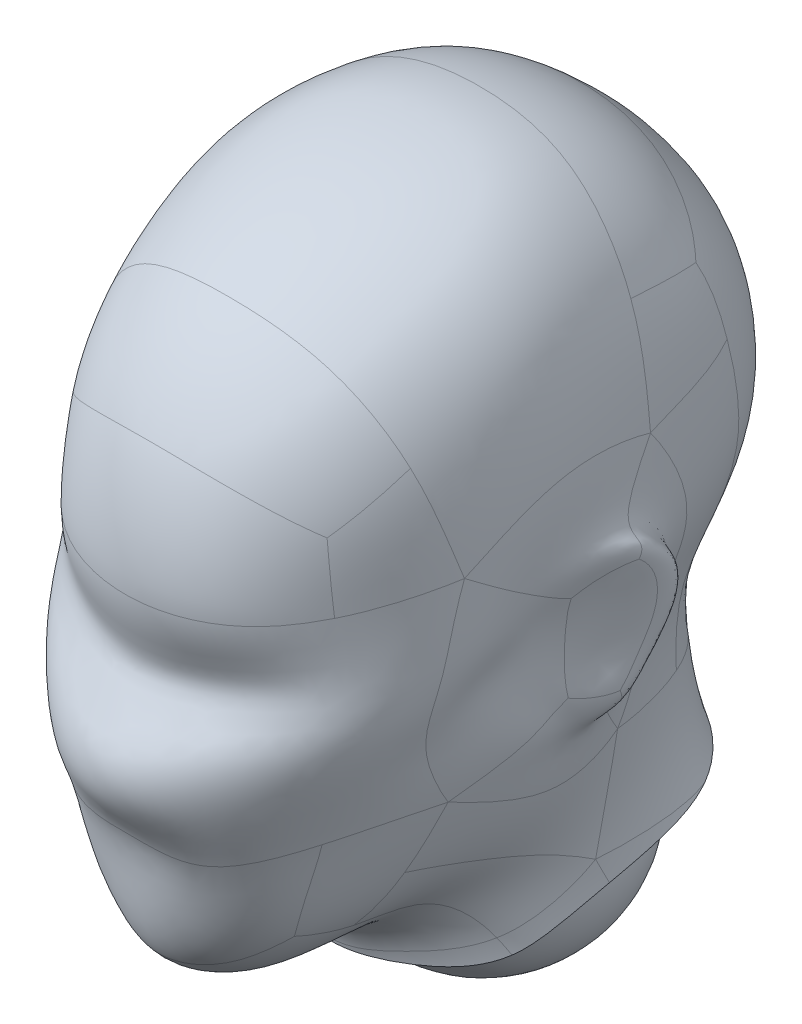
SolidWorks part; units mm, degrees
ref_plane "Front Plane" through (0, 0, 0) normal (0, 0, 1) x (1, 0, 0)
ref_plane "Top Plane" through (0, 0, 0) normal (0, 1, 0) x (1, 0, 0)
ref_plane "Right Plane" through (0, 0, 0) normal (1, 0, 0) x (0, 0, -1)
imported_body "Stock-Source-1"
sketch "Sketch1" plane through (0, 0, 0) normal (1, 0, 0) x (0, 0, -1)
  line L0 (-150.613, 4231.5172) -> (-58.439, 4261.5991)
  line L1 (-161.7107, 4227.8954) -> (-139.5153, 4235.1391) construction
  line L2 (-69.6638, 4257.9358) -> (-47.2143, 4265.2624) construction
  arc A0 (-58.439, 4261.5991) -> (-150.613, 4231.5172) centre (-104.526, 4246.5582) cw
revolve "Revolve1" add sketch "Sketch1" angle 360 about L0
